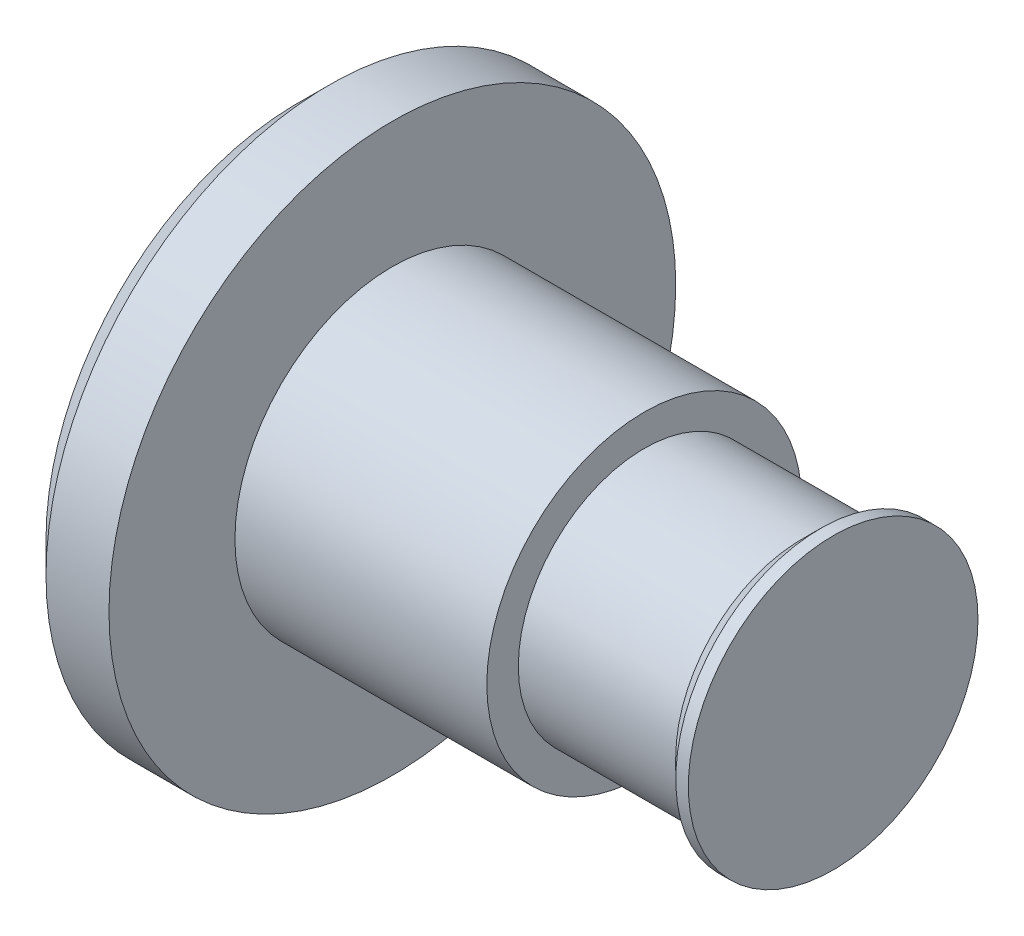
SolidWorks part; units mm, degrees
ref_plane "Plane1" through (0, 0, 0) normal (0, 0, 1) x (1, 0, 0)
ref_plane "Plane2" through (0, 0, 0) normal (0, 1, 0) x (1, 0, 0)
ref_plane "Plane3" through (0, 0, 0) normal (1, 0, 0) x (0, 0, -1)
sketch "Esquisse1" plane through (0, 0, 0) normal (0, 0, 1) x (1, 0, 0)
  line L0 (0, 0) -> (0, 4)
  line L1 (0, 4) -> (0.5, 4.5)
  line L2 (0.5, 4.5) -> (1.5, 4.5)
  line L3 (1.5, 4.5) -> (1.5, 2.5)
  line L4 (1.5, 2.5) -> (5.5, 2.5)
  line L5 (5.5, 2.5) -> (5.5, 2)
  line L6 (5.5, 2) -> (8, 2)
  line L7 (8, 2) -> (8.5, 2.5)
  line L8 (8.5, 2.5) -> (8.5, 0)
  line L9 (8.5, 0) -> (0, 0)
  line L10 (-1.4, 0) -> (12.1, 0) construction
revolve "Base-Révolution" add sketch "Esquisse1" angle 360 about L10
sketch "Esquisse3" plane through (8.5, 0, 0) normal (1, 0, 0) x (0, 0, -1)
  circle A0 centre (0, 0) radius 2.3
  circle A1 centre (0, 0) radius 2.8284
extrude "Enlèv. mat.-Extru.2" cut sketch "Esquisse3" against normal blind 2
